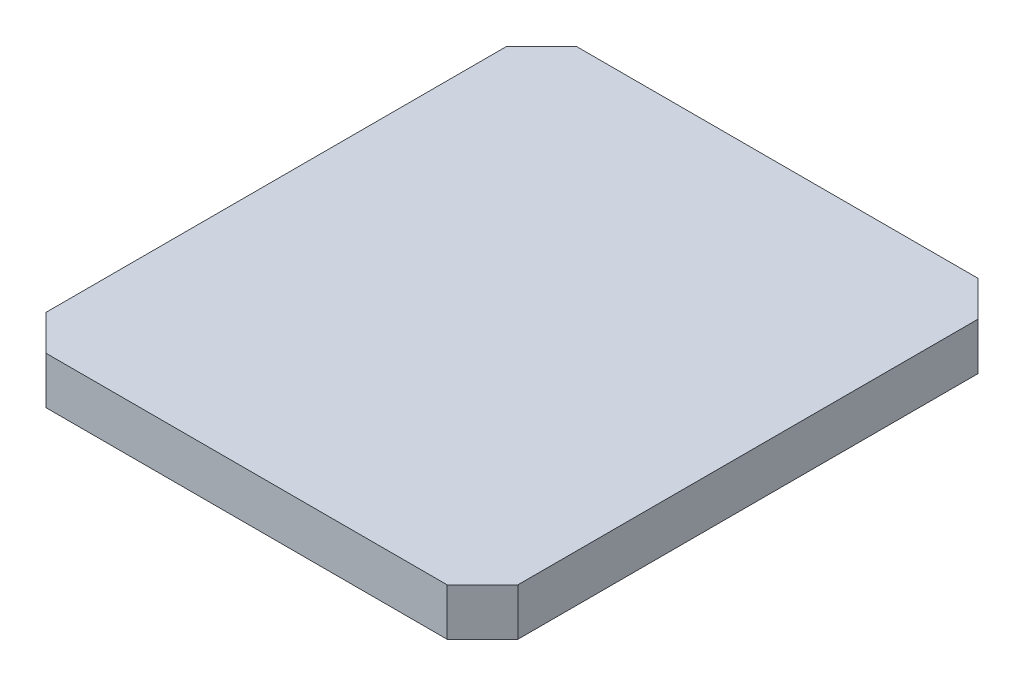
SolidWorks part; units mm, degrees
ref_plane "Front" through (0, 0, 0) normal (0, 0, 1) x (1, 0, 0)
ref_plane "Top" through (0, 0, 0) normal (0, 1, 0) x (1, 0, 0)
ref_plane "Right" through (0, 0, 0) normal (1, 0, 0) x (0, 0, -1)
sketch "Sketch1" plane through (0, 0, 0) normal (0, 1, 0) x (1, 0, 0)
  line L1 (-508, -571.5) -> (508, -571.5)
  line L2 (-508, -571.5) -> (-508, 571.5)
  line L3 (-508, 571.5) -> (508, 571.5)
  line L4 (508, -571.5) -> (508, 571.5)
  line L5 (-508, -571.5) -> (508, 571.5) construction
  line L6 (-508, 571.5) -> (508, -571.5) construction
  point P0 (0, 0)
  dimension "D1" = 1016
  dimension "D2" = 1143
extrude "Boss-Extrude1" add sketch "Sketch1" along normal blind 101.6
sketch "Sketch2" plane through (0, 0, 0) normal (0, 1, 0) x (1, 0, 0)
  line L0 (-508, 495.3) -> (-431.8, 571.5)
  line L1 (-508, -571.5) -> (-508, 571.5) construction
  line L2 (-508, 571.5) -> (508, 571.5) construction
  line L3 (-508, 495.3) -> (-533.4, 495.3)
  line L4 (-533.4, 495.3) -> (-533.4, 596.9)
  line L5 (-533.4, 596.9) -> (-431.8, 596.9)
  line L6 (-431.8, 596.9) -> (-431.8, 571.5)
  point P6 (-431.8, 680.7697)
  dimension "D1" = 45
  dimension "D2" = 76.2
  dimension "D3" = 25.4
extrude "Cut-Extrude1" cut sketch "Sketch2" along normal through all both and the other way through all
mirror "Mirror1" about plane through (0, 0, 0) normal (0, 0, 1) of "Cut-Extrude1"
